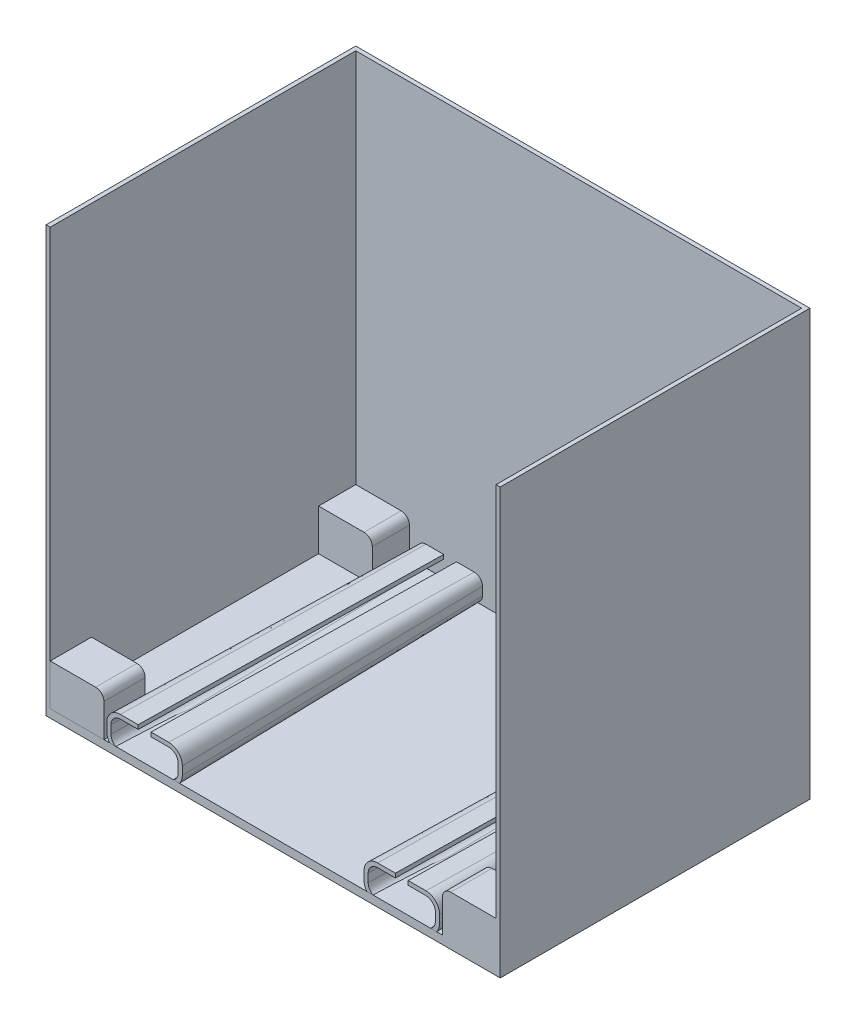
SolidWorks part; units mm, degrees
ref_plane "Front Plane" through (0, 0, 0) normal (0, 0, 1) x (1, 0, 0)
ref_plane "Top Plane" through (0, 0, 0) normal (0, 1, 0) x (1, 0, 0)
ref_plane "Right Plane" through (0, 0, 0) normal (1, 0, 0) x (0, 0, -1)
sketch "Sketch1" plane through (0, 0, 0) normal (0, 1, 0) x (1, 0, 0)
  line L1 (-55, -37.5) -> (55, -37.5)
  line L2 (-55, -37.5) -> (-55, 37.5)
  line L3 (-55, 37.5) -> (55, 37.5)
  line L4 (55, -37.5) -> (55, 37.5)
  line L5 (-55, -37.5) -> (55, 37.5) construction
  line L6 (-55, 37.5) -> (55, -37.5) construction
  point P0 (0, 0)
  dimension "D1" = 110
  dimension "D2" = 75
extrude "Boss-Extrude1" add sketch "Sketch1" along normal mid plane 103
shell "Shell1" thickness 1
sketch "Sketch3" plane through (0, 0, -36.5) normal (0, 0, 1) x (1, 0, 0)
  line L0 (-54, 51.5) -> (-54, -49.5) construction
  line L1 (-37, -48.5) -> (-25.3, -48.5)
  line L2 (-38, -47.5) -> (-38, -45.5)
  line L3 (-37, -44.5) -> (-25.3, -44.5)
  line L4 (-24.3, -47.5) -> (-24.3, -45.5)
  line L5 (-38, -48.5) -> (-24.3, -44.5) construction
  line L6 (-38, -44.5) -> (-24.3, -48.5) construction
  line L7 (54, -49.5) -> (-54, -49.5) construction
  line L8 (0, -41.25) -> (0, 41.25) construction
  line L9 (37, -44.5) -> (25.3, -44.5)
  line L10 (24.3, -47.5) -> (24.3, -45.5)
  line L11 (37, -48.5) -> (25.3, -48.5)
  line L12 (38, -47.5) -> (38, -45.5)
  arc A0 (-37, -48.5) -> (-38, -47.5) centre (-37, -47.5) cw
  arc A1 (-25.3, -48.5) -> (-24.3, -47.5) centre (-25.3, -47.5) ccw
  arc A2 (-25.3, -44.5) -> (-24.3, -45.5) centre (-25.3, -45.5) cw
  arc A3 (-38, -45.5) -> (-37, -44.5) centre (-37, -45.5) cw
  arc A4 (25.3, -44.5) -> (24.3, -45.5) centre (25.3, -45.5) ccw
  arc A5 (25.3, -48.5) -> (24.3, -47.5) centre (25.3, -47.5) cw
  arc A6 (37, -48.5) -> (38, -47.5) centre (37, -47.5) ccw
  arc A7 (38, -45.5) -> (37, -44.5) centre (37, -45.5) ccw
  point P0 (-31.15, -46.5)
  dimension "D5" = 1
  dimension "D1" = 4
  dimension "D2" = 13.7
  dimension "D3" = 16
  dimension "D4" = 5
extrude "Boss-Extrude4" add sketch "Sketch3" along normal up to surface (74 mm away) draft 1 separate body
shell "Shell3" thickness 1
shell "Shell4" thickness 1
sketch "Sketch4" plane through (0, 0, 37.5) normal (0, 0, 1) x (1, 0, 0)
  line L0 (-37, -43.2083) -> (-25.3, -43.2083) construction
  line L1 (-32.7, -44.7083) -> (-29.6, -44.7083)
  line L2 (-32.7, -44.7083) -> (-32.7, -41.7083)
  line L3 (-32.7, -41.7083) -> (-29.6, -41.7083)
  line L4 (-29.6, -44.7083) -> (-29.6, -41.7083)
  line L5 (-32.7, -44.7083) -> (-29.6, -41.7083) construction
  line L6 (-32.7, -41.7083) -> (-29.6, -44.7083) construction
  line L7 (0, -41.25) -> (0, 41.25) construction
  line L8 (32.7, -41.7083) -> (29.6, -41.7083)
  line L9 (29.6, -44.7083) -> (29.6, -41.7083)
  line L10 (32.7, -44.7083) -> (29.6, -44.7083)
  line L11 (32.7, -44.7083) -> (32.7, -41.7083)
  point P0 (-31.15, -43.2083)
  point P5 (0, 0)
  point P6 (-31.1752, -43.1868)
  point P7 (0, 0)
  point P8 (-31.0972, -43.3071)
  point P9 (-31.15, -43.2083)
  dimension "D1" = 3.1
  dimension "D2" = 3
extrude "Cut-Extrude1" cut sketch "Sketch4" against normal up to surface (74 mm away)
sketch "Sketch5" plane through (0, 0, 37.5) normal (0, 0, 1) x (1, 0, 0)
  line L0 (-55, 51.5) -> (-55, -51.5) construction
  line L1 (-54, -49.5) -> (-41, -49.5)
  line L2 (-54, -49.5) -> (-54, -39.5)
  line L3 (-54, -39.5) -> (-43, -39.5)
  line L4 (-41, -49.5) -> (-41, -41.5)
  line L5 (-55, -51.5) -> (55, -51.5) construction
  arc A0 (-43, -39.5) -> (-41, -41.5) centre (-43, -41.5) cw
  dimension "D3" = 2
  dimension "D1" = 14
  dimension "D2" = 12
extrude "Boss-Extrude5" add sketch "Sketch5" against normal blind 10 separate body
mirror "Mirror5" about plane through (0, 0, 0) normal (0, 0, 1) of "Boss-Extrude5"
sketch "Sketch6" plane through (0, -51.5, 0) normal (0, -1, 0) x (1, 0, 0)
  line L0 (-55, -37.5) -> (-55, 37.5) construction
  line L1 (-55, 37.5) -> (55, 37.5) construction
  line L2 (0, -41.25) -> (0, 41.25) construction
  line L3 (56.65, 0) -> (-56.65, 0) construction
  point P0 (-47, 31.5)
  point P1 (0, 0)
  point P2 (0, 0)
  point P8 (0, 0)
  point P10 (47, 31.5)
  point P11 (0, 0)
  point P14 (-47, -31.5)
  point P15 (47, -31.5)
  dimension "D1" = 8
  dimension "D2" = 6
hole_wizard "#6 (0.204) Diameter Hole1" positions "Sketch7" profile "Sketch8" hole size "#6" standard "ANSI Inch"
sketch "Sketch7" plane through (0, -51.5, 0) normal (0, -1, 0) x (-1, 0, 0)
  point P0 (47, -31.5)
  point P3 (47, 31.5)
  point P6 (-47, 31.5)
  point P9 (-47, -31.5)
sketch "Sketch8" plane through (-47, -51.5, 31.5) normal (1, 0, 0) x (0, 0, -1)
  line L0 (0, 0) -> (0, 8)
  line L1 (0, 8) -> (2.5908, 6.4433)
  line L2 (2.5908, 6.4433) -> (2.5908, 0)
  line L5 (2.5908, 0) -> (0, 0)
  line L10 (0, 8) -> (-2.5908, 6.4433) construction
  line L11 (0, -6.35) -> (0, 107.95) construction
  dimension "Hole Dia." = 5.1816
  dimension "Hole Depth" = 8
  dimension "Drill Angle" = 118
